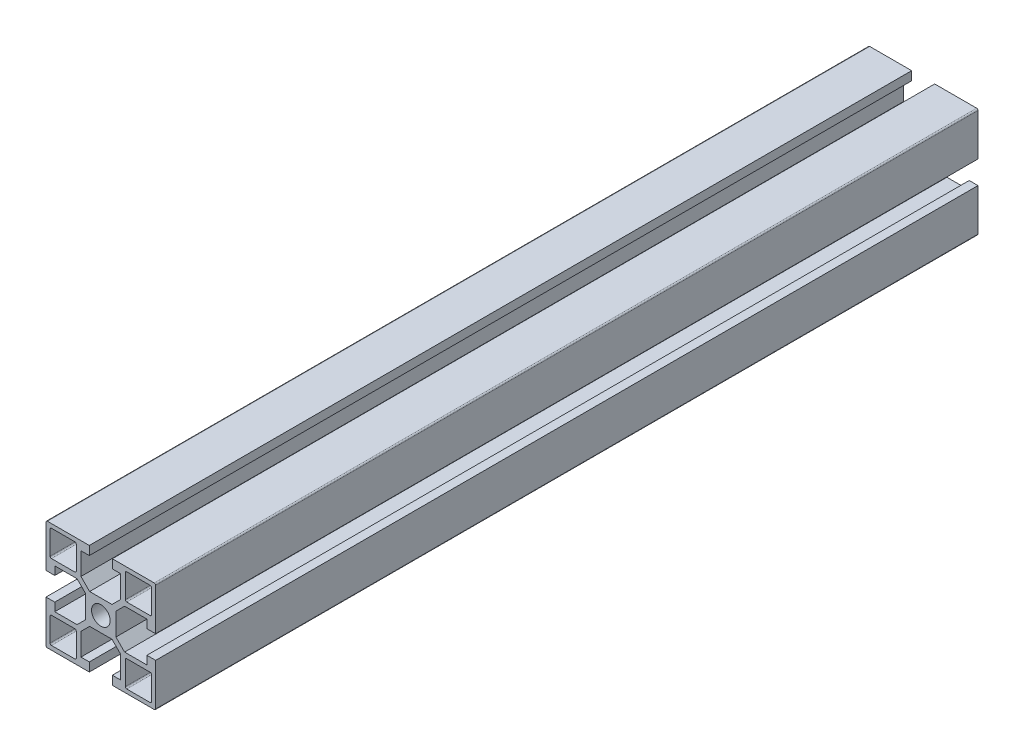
SolidWorks part; units mm, degrees
ref_plane "前视基准面" through (0, 0, 0) normal (0, 0, 1) x (1, 0, 0)
ref_plane "上视基准面" through (0, 0, 0) normal (0, 1, 0) x (1, 0, 0)
ref_plane "右视基准面" through (0, 0, 0) normal (1, 0, 0) x (0, 0, -1)
sketch "草图1" plane through (0, 0, 0) normal (0, 0, 1) x (1, 0, 0)
  line L0 (20, -4.2) -> (16.8, -4.2)
  line L1 (16.8, -4.2) -> (16.8, -7.25)
  line L2 (16.8, -7.25) -> (8.6642, -7.25)
  line L3 (8.6642, -7.25) -> (5.5, -4.0858)
  line L4 (5.5, -4.0858) -> (5.5, 0)
  line L5 (5.5, 0) -> (5.5, 4.0858)
  line L6 (5.5, 4.0858) -> (8.6642, 7.25)
  line L7 (8.6642, 7.25) -> (16.8, 7.25)
  line L8 (16.8, 7.25) -> (16.8, 4.2)
  line L9 (16.8, 4.2) -> (20, 4.2)
  line L10 (20, 4.2) -> (20, 19.5)
  line L11 (19.5, 20) -> (4.2, 20)
  line L12 (4.2, 20) -> (4.2, 16.8)
  line L13 (4.2, 16.8) -> (7.25, 16.8)
  line L14 (7.25, 16.8) -> (7.25, 8.6642)
  line L15 (7.25, 8.6642) -> (4.0858, 5.5)
  line L16 (4.0858, 5.5) -> (0, 5.5)
  line L17 (0, 5.5) -> (-4.0858, 5.5)
  line L18 (-4.0858, 5.5) -> (-7.25, 8.6642)
  line L19 (-7.25, 8.6642) -> (-7.25, 16.8)
  line L20 (-7.25, 16.8) -> (-4.2, 16.8)
  line L21 (-4.2, 16.8) -> (-4.2, 20)
  line L22 (-4.2, 20) -> (-19.5, 20)
  line L23 (-20, 19.5) -> (-20, 4.2)
  line L24 (-20, 4.2) -> (-16.8, 4.2)
  line L25 (-16.8, 4.2) -> (-16.8, 7.25)
  line L26 (-16.8, 7.25) -> (-8.6642, 7.25)
  line L27 (-8.6642, 7.25) -> (-5.5, 4.0858)
  line L28 (-5.5, 4.0858) -> (-5.5, 0)
  line L29 (-5.5, 0) -> (-5.5, -4.0858)
  line L30 (-5.5, -4.0858) -> (-8.6642, -7.25)
  line L31 (-8.6642, -7.25) -> (-16.8, -7.25)
  line L32 (-16.8, -7.25) -> (-16.8, -4.2)
  line L33 (-16.8, -4.2) -> (-20, -4.2)
  line L34 (-20, -4.2) -> (-20, -19.5)
  line L35 (-19.5, -20) -> (-4.2, -20)
  line L36 (-4.2, -20) -> (-4.2, -16.8)
  line L37 (-4.2, -16.8) -> (-7.25, -16.8)
  line L38 (-7.25, -16.8) -> (-7.25, -8.6642)
  line L39 (-7.25, -8.6642) -> (-4.0858, -5.5)
  line L40 (-4.0858, -5.5) -> (0, -5.5)
  line L41 (0, -5.5) -> (4.0858, -5.5)
  line L42 (4.0858, -5.5) -> (7.25, -8.6642)
  line L43 (7.25, -8.6642) -> (7.25, -16.8)
  line L44 (7.25, -16.8) -> (4.2, -16.8)
  line L45 (4.2, -16.8) -> (4.2, -20)
  line L46 (4.2, -20) -> (19.5, -20)
  line L47 (20, -19.5) -> (20, -4.2)
  line L48 (-9.4506, 18.5269) -> (-18, 18.5269)
  line L49 (-18.5, 18.0269) -> (-18.5, 9.4541)
  line L50 (-18, 8.9541) -> (-9.4506, 8.9541)
  line L51 (-8.9506, 9.4541) -> (-8.9506, 18.0269)
  line L52 (-18.5269, -9.4506) -> (-18.5269, -18)
  line L53 (-18.0269, -18.5) -> (-9.4541, -18.5)
  line L54 (-8.9541, -18) -> (-8.9541, -9.4506)
  line L55 (-9.4541, -8.9506) -> (-18.0269, -8.9506)
  line L56 (9.4506, -18.5269) -> (18, -18.5269)
  line L57 (18.5, -18.0269) -> (18.5, -9.4541)
  line L58 (18, -8.9541) -> (9.4506, -8.9541)
  line L59 (8.9506, -9.4541) -> (8.9506, -18.0269)
  line L60 (18.5269, 9.4506) -> (18.5269, 18)
  line L61 (18.0269, 18.5) -> (9.4541, 18.5)
  line L62 (8.9541, 18) -> (8.9541, 9.4506)
  line L63 (9.4541, 8.9506) -> (18.0269, 8.9506)
  arc A0 (20, 19.5) -> (19.5, 20) centre (19.5, 19.5) ccw
  arc A1 (-19.5, 20) -> (-20, 19.5) centre (-19.5, 19.5) ccw
  arc A2 (-20, -19.5) -> (-19.5, -20) centre (-19.5, -19.5) ccw
  arc A3 (19.5, -20) -> (20, -19.5) centre (19.5, -19.5) ccw
  arc A4 (-8.9506, 18.0269) -> (-9.4506, 18.5269) centre (-9.4506, 18.0269) ccw
  arc A5 (-18, 18.5269) -> (-18.5, 18.0269) centre (-18, 18.0269) ccw
  arc A6 (-18.5, 9.4541) -> (-18, 8.9541) centre (-18, 9.4541) ccw
  arc A7 (-9.4506, 8.9541) -> (-8.9506, 9.4541) centre (-9.4506, 9.4541) ccw
  arc A8 (-18.0269, -8.9506) -> (-18.5269, -9.4506) centre (-18.0269, -9.4506) ccw
  arc A9 (-18.5269, -18) -> (-18.0269, -18.5) centre (-18.0269, -18) ccw
  arc A10 (-9.4541, -18.5) -> (-8.9541, -18) centre (-9.4541, -18) ccw
  arc A11 (-8.9541, -9.4506) -> (-9.4541, -8.9506) centre (-9.4541, -9.4506) ccw
  arc A12 (8.9506, -18.0269) -> (9.4506, -18.5269) centre (9.4506, -18.0269) ccw
  arc A13 (18, -18.5269) -> (18.5, -18.0269) centre (18, -18.0269) ccw
  arc A14 (18.5, -9.4541) -> (18, -8.9541) centre (18, -9.4541) ccw
  arc A15 (9.4506, -8.9541) -> (8.9506, -9.4541) centre (9.4506, -9.4541) ccw
  arc A16 (18.0269, 8.9506) -> (18.5269, 9.4506) centre (18.0269, 9.4506) ccw
  arc A17 (18.5269, 18) -> (18.0269, 18.5) centre (18.0269, 18) ccw
  arc A18 (9.4541, 18.5) -> (8.9541, 18) centre (9.4541, 18) ccw
  arc A19 (8.9541, 9.4506) -> (9.4541, 8.9506) centre (9.4541, 9.4506) ccw
  circle A20 centre (0, 0) radius 3.4
extrude "凸台-拉伸1" add sketch "草图1" along normal mid plane 300
